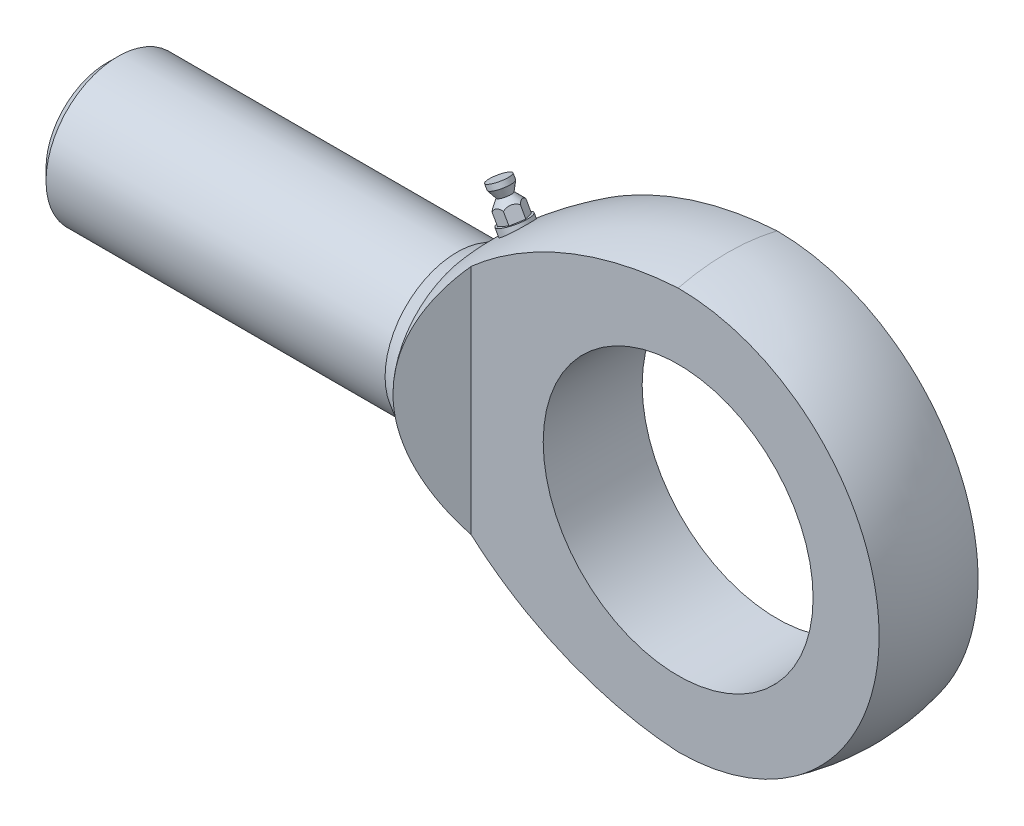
SolidWorks part; units mm, degrees
other "<Fixation Tirant_1>-<Embout>"
ref_plane "Plan de face" through (0, 0, 0) normal (0, 0, 1) x (1, 0, 0)
ref_plane "Plan de dessus" through (0, 0, 0) normal (0, 1, 0) x (1, 0, 0)
ref_plane "Plan de droite" through (0, 0, 0) normal (1, 0, 0) x (0, 0, -1)
mirrored part "Fixation Tirant_1_Symétrique"
